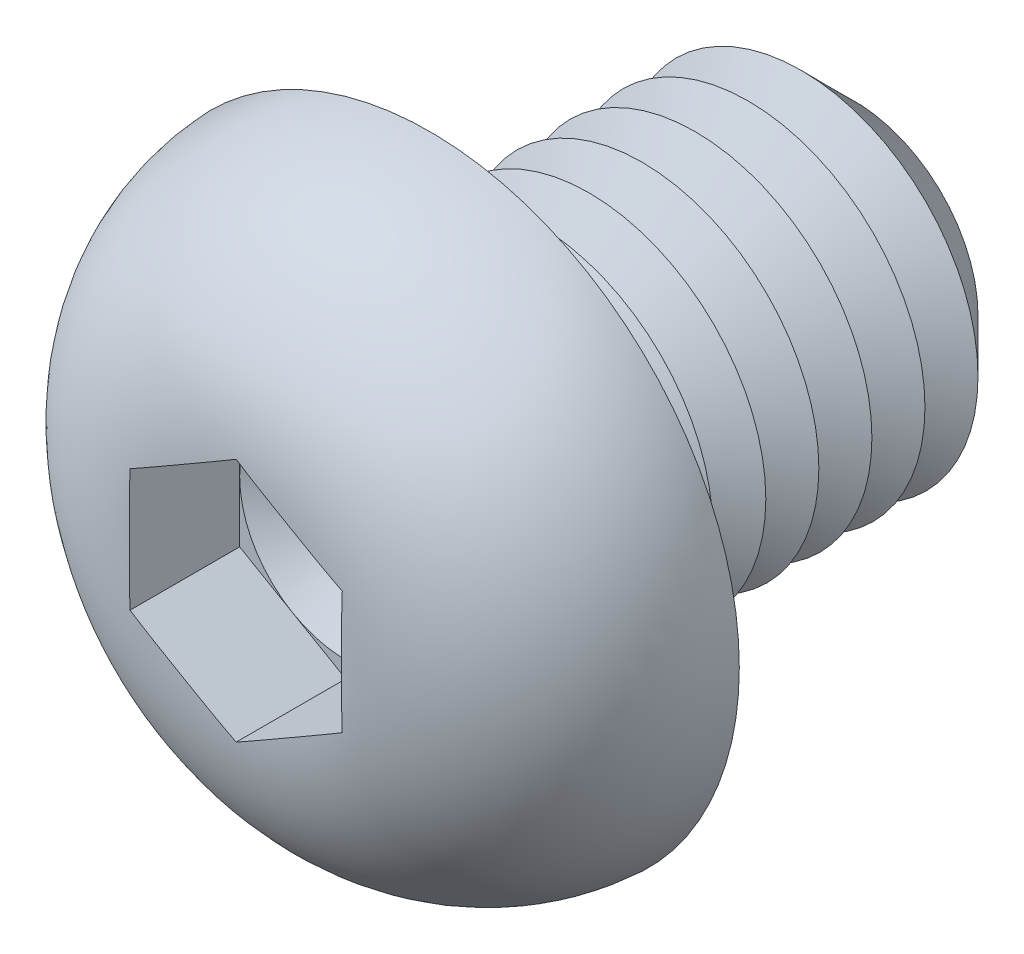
SolidWorks part; units mm, degrees
ref_plane "Front Plane" through (0, 0, 0) normal (0, 0, 1) x (1, 0, 0)
ref_plane "Top Plane" through (0, 0, 0) normal (0, 1, 0) x (1, 0, 0)
ref_plane "Right Plane" through (0, 0, 0) normal (1, 0, 0) x (0, 0, -1)
sketch "Sketch1" plane through (0, 0, 0) normal (1, 0, 0) x (0, 0, -1)
  line L0 (-47.9342, 0) -> (60.3146, 0) construction
sketch "Sketch2" plane through (0, 0, 0) normal (1, 0, 0) x (0, 0, -1)
  line L0 (0, 0) -> (-5.5, 0)
  line L1 (-47.9342, 0) -> (60.3146, 0) construction
  line L2 (-5.5, 0) -> (-5.5, 2.9578)
  line L3 (0, 8.75) -> (0, 0)
  arc A0 (-5.5, 2.9578) -> (0, 8.75) centre (0.3, 2.9578) cw
  dimension "D1" = 5.8
  dimension "D2" = 5.5
  dimension "D3" = 8.75
revolve "Revolve1" add sketch "Sketch2" angle 360 about L0
sketch "Sketch3" plane through (0, 0, 5.5) normal (0, 0, 1) x (1, 0, 0)
  line L1 (0, 3.4641) -> (-3, 1.7321)
  line L2 (-3, 1.7321) -> (-3, -1.7321)
  line L3 (-3, -1.7321) -> (0, -3.4641)
  line L4 (0, -3.4641) -> (3, -1.7321)
  line L5 (3, -1.7321) -> (3, 1.7321)
  line L6 (3, 1.7321) -> (0, 3.4641)
  circle A0 centre (0, 0) radius 3 construction
  dimension "D1" = 6
extrude "Cut-Extrude1" cut sketch "Sketch3" against normal blind 3.12
sketch "Sketch4" plane through (0, 0, 0) normal (0, 0, -1) x (-1, 0, 0)
  circle A0 centre (0, 0) radius 5
  dimension "D1" = 10
extrude "Boss-Extrude1" add sketch "Sketch4" along normal blind 12
chamfer "Chamfer1" distance 1.5 angle 45 1 edges at (-5, 0, -12)
sketch "Sketch5" plane through (0, 0, 0) normal (1, 0, 0) x (0, 0, -1)
  line L0 (1.5, 5) -> (3, 5)
  line L1 (10.5, 5) -> (0, 5) construction
  line L2 (3, 5) -> (2.25, 3.701)
  line L3 (2.25, 3.701) -> (1.5, 5)
  line L4 (0, -8.75) -> (0, 8.75) construction
  line L5 (10.5, 5) -> (0, 5) construction
  dimension "D1" = 1.5
  dimension "D2" = 1.5
revolve "Cut-Revolve1" cut sketch "Sketch5" angle 360 about L0
pattern_linear "LPattern1" count 6 spacing 1.5 along (0, 0, -1) of "Cut-Revolve1"
fillet "Fillet2" radius 0.6 1 edges at (5, 0, 0)
sketch "Sketch6" plane through (0, 0, 2.38) normal (0, 0, 1) x (1, 0, 0)
  line L0 (0, -3.4641) -> (3, -1.7321) construction
  circle A0 centre (0, 0) radius 3
extrude "Cut-Extrude2" cut sketch "Sketch6" against normal through all draft 60
